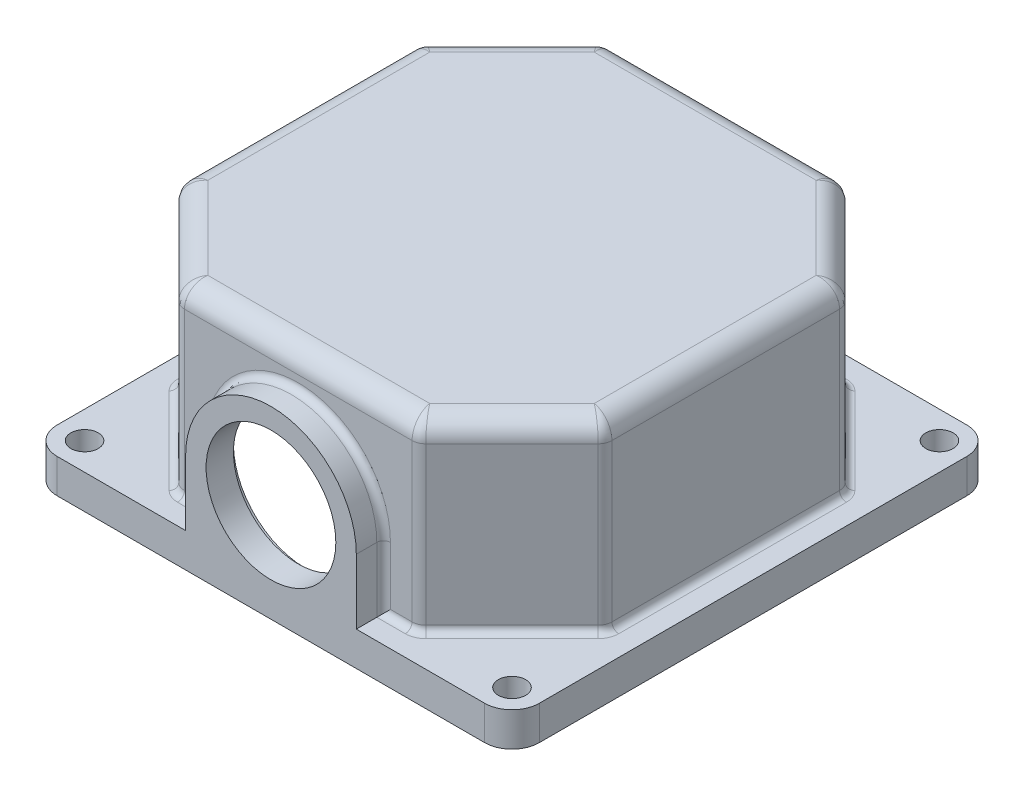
SolidWorks part; units mm, degrees
ref_plane "Front Plane" through (0, 0, 0) normal (0, 0, 1) x (1, 0, 0)
ref_plane "Top Plane" through (0, 0, 0) normal (0, 1, 0) x (1, 0, 0)
ref_plane "Right Plane" through (0, 0, 0) normal (1, 0, 0) x (0, 0, -1)
sketch "Sketch2" plane through (0, 0, 0) normal (0, 1, 0) x (1, 0, 0)
  line L0 (-12.5456, 31.0708) -> (20.7975, 31.0708)
  line L1 (22.2118, 30.485) -> (34.8402, 17.8566)
  line L2 (35.426, 16.4424) -> (35.426, -16.9008)
  line L3 (34.8402, -18.315) -> (22.2118, -30.9434)
  line L4 (20.7975, -31.5292) -> (-12.5456, -31.5292)
  line L5 (-13.9598, -30.9434) -> (-26.5882, -18.315)
  line L6 (-27.174, -16.9008) -> (-27.174, 16.4424)
  line L7 (-26.5882, 17.8566) -> (-13.9598, 30.485)
  arc A0 (20.7975, 31.0708) -> (22.2118, 30.485) centre (20.7975, 29.0708) cw
  arc A1 (34.8402, 17.8566) -> (35.426, 16.4424) centre (33.426, 16.4424) cw
  arc A2 (35.426, -16.9008) -> (34.8402, -18.315) centre (33.426, -16.9008) cw
  arc A3 (22.2118, -30.9434) -> (20.7975, -31.5292) centre (20.7975, -29.5292) cw
  arc A4 (-12.5456, -31.5292) -> (-13.9598, -30.9434) centre (-12.5456, -29.5292) cw
  arc A5 (-26.5882, -18.315) -> (-27.174, -16.9008) centre (-25.174, -16.9008) cw
  arc A6 (-27.174, 16.4424) -> (-26.5882, 17.8566) centre (-25.174, 16.4424) cw
  arc A7 (-12.5456, 31.0708) -> (-13.9598, 30.485) centre (-12.5456, 29.0708) ccw
  point P22 (21.626, 31.0708)
  point P33 (-27.174, -17.7292)
  point P36 (-27.174, 17.2708)
  point P39 (-13.374, 31.0708)
  dimension "D1" = 135
  dimension "D2" = 62.6
  dimension "D3" = 62.6
  dimension "D6" = 35
extrude "Boss-Extrude4" add sketch "Sketch2" along normal blind 27
shell "Shell2" thickness 1
sketch "Sketch1" plane through (0, 0, 0) normal (0, -1, 0) x (-1, 0, 0)
  line L0 (27.174, 16.4424) -> (27.174, -16.9008) construction
  line L1 (-35.426, 35.0708) -> (27.174, 35.0708)
  line L2 (-39.426, 31.0708) -> (-39.426, -31.5292)
  line L3 (-35.426, -35.5292) -> (27.174, -35.5292)
  line L4 (31.174, 31.0708) -> (31.174, -31.5292)
  line L5 (-20.7975, 31.0708) -> (12.5456, 31.0708) construction
  line L6 (12.5456, -31.5292) -> (-20.7975, -31.5292) construction
  line L7 (-35.426, -16.9008) -> (-35.426, 16.4424) construction
  line L28 (12.5456, 30.0708) -> (-20.7975, 30.0708)
  line L29 (-21.5047, 29.7779) -> (-34.1331, 17.1495)
  line L30 (-34.426, 16.4424) -> (-34.426, -16.9008)
  line L31 (-34.1331, -17.6079) -> (-21.5047, -30.2363)
  line L32 (-20.7975, -30.5292) -> (12.5456, -30.5292)
  line L33 (13.2527, -30.2363) -> (25.8811, -17.6079)
  line L34 (26.174, -16.9008) -> (26.174, 16.4424)
  line L35 (25.8811, 17.1495) -> (13.2527, 29.7779)
  line L36 (12.5456, 30.0708) -> (-20.7975, 30.0708)
  line L37 (-21.5047, 29.7779) -> (-34.1331, 17.1495)
  line L38 (-34.426, 16.4424) -> (-34.426, -16.9008)
  line L39 (-34.1331, -17.6079) -> (-21.5047, -30.2363)
  line L40 (-20.7975, -30.5292) -> (12.5456, -30.5292)
  line L41 (13.2527, -30.2363) -> (25.8811, -17.6079)
  line L42 (26.174, -16.9008) -> (26.174, 16.4424)
  line L43 (25.8811, 17.1495) -> (13.2527, 29.7779)
  arc A0 (-39.426, -31.5292) -> (-35.426, -35.5292) centre (-35.426, -31.5292) ccw
  arc A1 (27.174, -35.5292) -> (31.174, -31.5292) centre (27.174, -31.5292) ccw
  arc A2 (27.174, 35.0708) -> (31.174, 31.0708) centre (27.174, 31.0708) cw
  arc A3 (-35.426, 35.0708) -> (-39.426, 31.0708) centre (-35.426, 31.0708) ccw
  arc A22 (-20.7975, 30.0708) -> (-21.5047, 29.7779) centre (-20.7975, 29.0708) ccw
  arc A23 (-34.1331, 17.1495) -> (-34.426, 16.4424) centre (-33.426, 16.4424) ccw
  arc A24 (-34.426, -16.9008) -> (-34.1331, -17.6079) centre (-33.426, -16.9008) ccw
  arc A25 (-21.5047, -30.2363) -> (-20.7975, -30.5292) centre (-20.7975, -29.5292) ccw
  arc A26 (12.5456, -30.5292) -> (13.2527, -30.2363) centre (12.5456, -29.5292) ccw
  arc A27 (25.8811, -17.6079) -> (26.174, -16.9008) centre (25.174, -16.9008) ccw
  arc A28 (26.174, 16.4424) -> (25.8811, 17.1495) centre (25.174, 16.4424) ccw
  arc A29 (13.2527, 29.7779) -> (12.5456, 30.0708) centre (12.5456, 29.0708) ccw
  arc A30 (-20.7975, 30.0708) -> (-21.5047, 29.7779) centre (-20.7975, 29.0708) ccw
  arc A31 (-34.1331, 17.1495) -> (-34.426, 16.4424) centre (-33.426, 16.4424) ccw
  arc A32 (-34.426, -16.9008) -> (-34.1331, -17.6079) centre (-33.426, -16.9008) ccw
  arc A33 (-21.5047, -30.2363) -> (-20.7975, -30.5292) centre (-20.7975, -29.5292) ccw
  arc A34 (12.5456, -30.5292) -> (13.2527, -30.2363) centre (12.5456, -29.5292) ccw
  arc A35 (25.8811, -17.6079) -> (26.174, -16.9008) centre (25.174, -16.9008) ccw
  arc A36 (26.174, 16.4424) -> (25.8811, 17.1495) centre (25.174, 16.4424) ccw
  arc A37 (13.2527, 29.7779) -> (12.5456, 30.0708) centre (12.5456, 29.0708) ccw
  point P10 (31.174, 35.0708)
  point P13 (-39.426, 35.0708)
  dimension "D2" = 4
  dimension "D1" = 70.6
  dimension "D3" = 4
  dimension "D4" = 4
  dimension "D5" = 4
  dimension "D6" = 4
  dimension "D7" = 1
extrude "Boss-Extrude5" add sketch "Sketch1" along normal blind 5
sketch "Sketch5" plane through (0, 0, 35.5292) normal (0, 0, 1) x (1, 0, 0)
  line L0 (4.126, -1005) -> (4.126, 48995) construction
  line L1 (35.426, -5) -> (-27.174, -5) construction
  line L2 (35.426, 0) -> (-27.174, 0) construction
  line L3 (-8.374, 9.5) -> (-8.374, -5)
  line L4 (-8.374, -5) -> (16.626, -5)
  line L5 (16.626, -5) -> (16.626, 9.5)
  circle A0 centre (4.126, 9.5) radius 9.5
  arc A1 (16.626, 9.5) -> (-8.374, 9.5) centre (4.126, 9.5) ccw
  circle A2 centre (4.126, 9.5) radius 12.5 construction
  point P7 (4.126, -5)
  dimension "D2" = 19
  dimension "D1" = 3
extrude "Boss-Extrude6" add sketch "Sketch5" against normal up to surface (4 mm away)
sketch "Sketch6" plane through (0, 0, 31.5292) normal (0, 0, 1) x (1, 0, 0)
  circle A0 centre (4.126, 9.5) radius 10.5
extrude "Cut-Extrude3" cut sketch "Sketch6" against normal up to next
hole_wizard "Ø4.0 (4) Diameter Hole1" positions "Sketch8" profile "Sketch9" hole size "Ø4.0" standard "ANSI Metric"
sketch "Sketch8" plane through (0, 0, 0) normal (0, 1, 0) x (1, 0, 0)
  point P0 (-27.174, -31.5292)
  point P4 (35.426, -31.5292)
  point P8 (35.426, 31.0708)
  point P12 (-27.174, 31.0708)
sketch "Sketch9" plane through (-27.174, 0, 31.5292) normal (1, 0, 0) x (0, 0, 1)
  line L0 (0, 0) -> (0, 5)
  line L1 (0, 5) -> (2, 5)
  line L2 (2, 5) -> (2, 0)
  line L5 (2, 0) -> (0, 0)
  line L11 (0, -6.35) -> (0, 107.95) construction
  dimension "Thru Hole Dia." = 4
  dimension "Thru Hole Depth" = 5
fillet "Fillet3" radius 1 36 edges at (18.7118, 0, 31.5292) (21.5629, 0, 31.377) (-10.4598, 0, 31.5292) (-13.311, 0, 31.377) (-20.274, 0, 24.6292) (-27.0218, 0, 17.6662) (-27.174, 0, 0.2292) (-27.0218, 0, -17.2077) (-20.274, 0, -24.1708) (-13.311, 0, -30.9185) (4.126, 0, -31.0708) (21.5629, 0, -30.9185) (28.526, 0, -24.1708) (35.2737, 0, -17.2077) (35.426, 0, 0.2292) (35.2737, 0, 17.6662) (21.1802, 26, 30.4531) (4.126, 26, 30.5292) (-12.9283, 26, 30.4531) (-19.5669, 26, 23.9221) (-26.0979, 26, 17.2835) (-26.174, 26, 0.2292) (-26.0979, 26, -16.825) (-19.5669, 26, -23.4637) (-12.9283, 26, -29.9947) (4.126, 26, -30.0708) (21.1802, 26, -29.9947) (27.8189, 26, -23.4637) (34.3499, 26, -16.825) (34.426, 26, 0.2292) (34.3499, 26, 17.2835) (28.526, 0, 24.6292) (27.8189, 26, 23.9221) (-8.374, 4.75, 31.5292) (4.126, 22, 31.5292) (16.626, 4.75, 31.5292)
fillet "Fillet4" radius 3 16 edges at (21.5629, 27, 31.377) (4.126, 27, 31.5292) (-13.311, 27, 31.377) (-20.274, 27, 24.6292) (-27.0218, 27, 17.6662) (-27.174, 27, 0.2292) (-27.0218, 27, -17.2077) (-20.274, 27, -24.1708) (-13.311, 27, -30.9185) (4.126, 27, -31.0708) (21.5629, 27, -30.9185) (28.526, 27, -24.1708) (35.2737, 27, -17.2077) (35.426, 27, 0.2292) (35.2737, 27, 17.6662) (28.526, 27, 24.6292)
